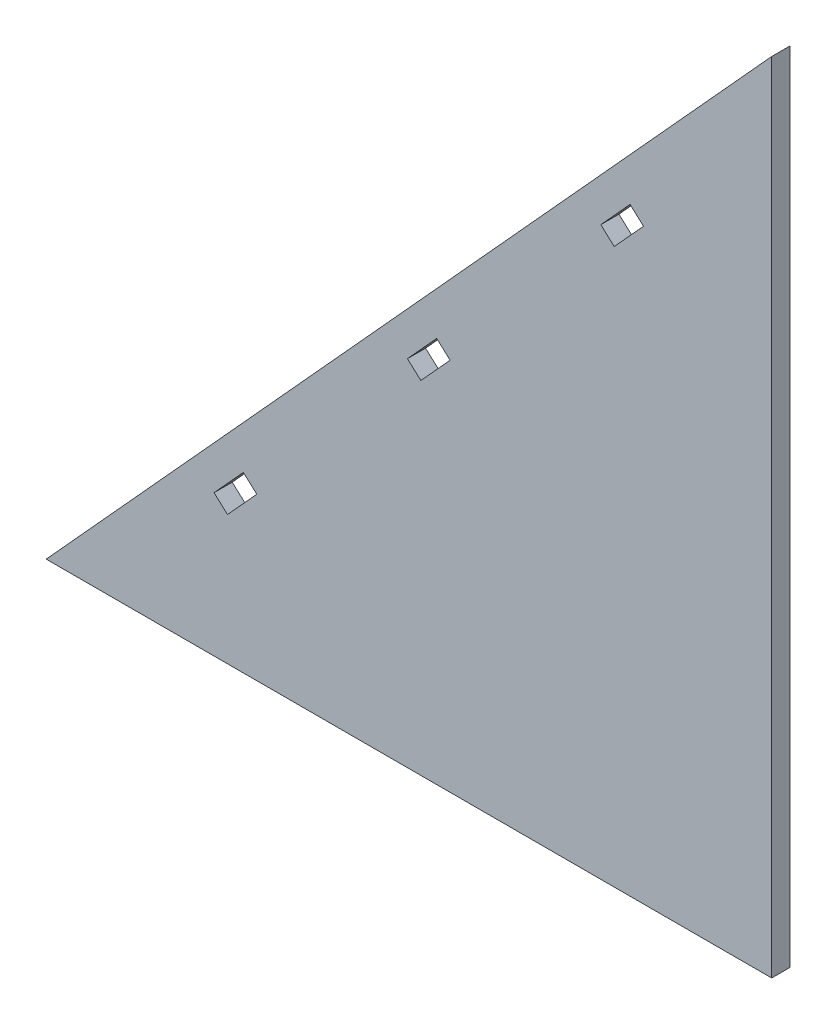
SolidWorks part; units mm, degrees
ref_plane "前视基准面" through (0, 0, 0) normal (0, 0, 1) x (1, 0, 0)
ref_plane "上视基准面" through (0, 0, 0) normal (0, 1, 0) x (1, 0, 0)
ref_plane "右视基准面" through (0, 0, 0) normal (1, 0, 0) x (0, 0, -1)
sketch "草图1" plane through (0, 0, 0) normal (0, 0, 1) x (1, 0, 0)
  line L0 (-0.7453, -12.1872) -> (99.2547, -12.1872)
  line L1 (99.2547, -12.1872) -> (99.2547, 97.8128)
  line L11 (99.2547, 97.8128) -> (-0.7453, -12.1872)
  line L13 (75.6996, 65.9557) -> (79.7356, 70.3954)
  line L14 (75.6996, 65.9557) -> (77.5494, 64.2741)
  line L15 (77.5494, 64.2741) -> (81.5855, 68.7137)
  line L16 (79.7356, 70.3954) -> (81.5855, 68.7137)
  line L17 (49.049, 36.6363) -> (53.085, 41.0759)
  line L18 (49.049, 36.6363) -> (50.8988, 34.9546)
  line L19 (50.8988, 34.9546) -> (54.9349, 39.3943)
  line L20 (53.085, 41.0759) -> (54.9349, 39.3943)
  line L22 (22.3984, 7.3169) -> (26.4344, 11.7565)
  line L23 (22.3984, 7.3169) -> (24.2482, 5.6352)
  line L24 (24.2482, 5.6352) -> (28.2843, 10.0748)
  line L25 (26.4344, 11.7565) -> (28.2843, 10.0748)
  dimension "D1" = 100
  dimension "D2" = 110
  dimension "D3" = 6
  dimension "D4" = 2.5
  dimension "D5" = 4
  dimension "D6" = 3
  dimension "D9" = 30
extrude "凸台-拉伸1" add sketch "草图1" along normal blind 2.5
